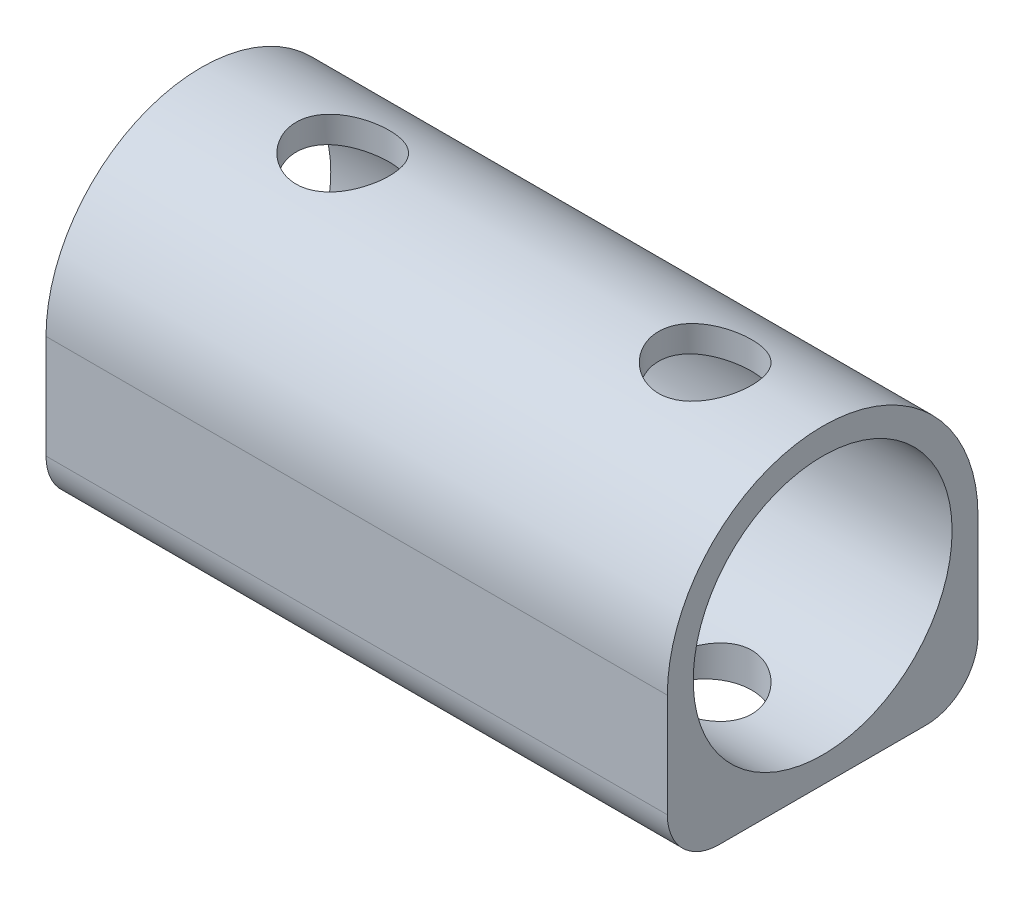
SolidWorks part; units mm, degrees
ref_plane "Front" through (0, 0, 0) normal (0, 0, 1) x (1, 0, 0)
ref_plane "Top" through (0, 0, 0) normal (0, 1, 0) x (1, 0, 0)
ref_plane "Right" through (0, 0, 0) normal (1, 0, 0) x (0, 0, -1)
sketch "Sketch1" plane through (0, 0, 0) normal (1, 0, 0) x (0, 0, -1)
  line L0 (19.05, 0) -> (19.05, -19.05)
  line L1 (-19.05, 0) -> (-19.05, -19.05)
  line L2 (-19.05, -19.05) -> (19.05, -19.05)
  arc A1 (19.05, 0) -> (-19.05, 0) centre (0, 0) ccw
  point P7 (0, 0)
  dimension "D4" = 19.05
  dimension "D5" = 38.1
extrude "Base-Extrude" add sketch "Sketch1" against normal blind 76.2
sketch "Sketch3" plane through (0, 0, 0) normal (1, 0, 0) x (0, 0, -1)
  circle A0 centre (0, 0) radius 15.875
  dimension "D1" = 31.75
extrude "Cut-Extrude2" cut sketch "Sketch3" against normal through all
sketch "Sketch2" plane through (0, -19.05, 0) normal (0, -1, 0) x (1, 0, 0)
  line L0 (-36.6348, 0) -> (-36.6348, -46.1898) construction
  line L3 (50, 0) -> (-50, 0) construction
  circle A0 centre (-14.4098, 0) radius 5.715
  circle A1 centre (-58.8598, 0) radius 5.715
  dimension "D1" = 44.45
  dimension "D2" = 11.43
extrude "Cut-Extrude1" cut sketch "Sketch2" against normal through all
fillet "Fillet1" radius 6.35 2 edges at (-38.1, -19.05, 19.05) (-38.1, -19.05, -19.05)
